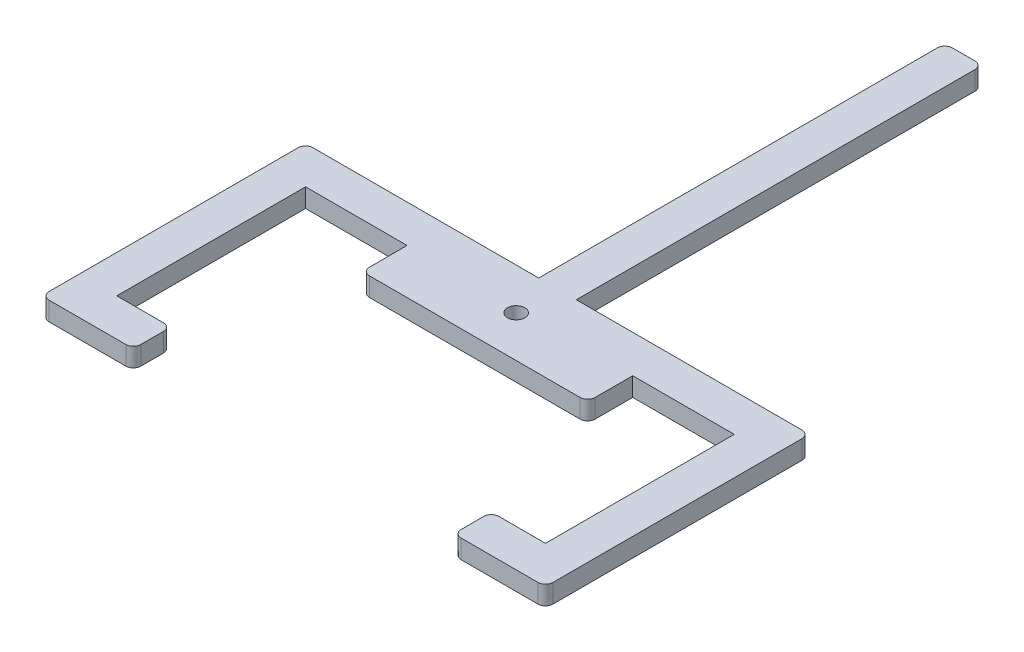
SolidWorks part; units mm, degrees
ref_plane "Front Plane" through (0, 0, 0) normal (0, 0, 1) x (1, 0, 0)
ref_plane "Top Plane" through (0, 0, 0) normal (0, 1, 0) x (1, 0, 0)
ref_plane "Right Plane" through (0, 0, 0) normal (1, 0, 0) x (0, 0, -1)
sketch "Sketch1" plane through (0, 0, 0) normal (0, 1, 0) x (1, 0, 0)
  line L0 (0, 0) -> (0, -68.58)
  line L1 (0, -79.375) -> (-15.875, -79.375)
  line L2 (-39.37, -68.58) -> (-39.37, -109.982)
  line L3 (-39.37, -109.982) -> (-33.02, -109.982)
  line L4 (0, -74.93) -> (0, -79.375)
  line L5 (-15.875, -82.55) -> (22.225, -82.55)
  line L6 (39.37, -74.93) -> (39.37, -109.982)
  line L7 (39.37, -109.982) -> (45.72, -109.982)
  line L8 (45.72, -68.58) -> (45.72, -109.982)
  line L9 (22.225, -79.375) -> (6.35, -79.375)
  line L10 (0, -68.58) -> (6.35, -68.58) construction
  line L11 (6.35, 0) -> (0, 0)
  line L12 (0, -74.93) -> (-33.02, -74.93)
  line L13 (-33.02, -74.93) -> (-33.02, -109.982)
  line L14 (0, -68.58) -> (-39.37, -68.58)
  line L15 (6.35, -77.1525) -> (0, -77.1525) construction
  line L16 (-15.875, -79.375) -> (-15.875, -82.55)
  line L18 (22.225, -79.375) -> (22.225, -82.55)
  line L19 (6.35, -68.58) -> (45.72, -68.58)
  line L20 (6.35, -74.93) -> (6.35, -79.375)
  line L21 (3.175, -77.1525) -> (3.175, -82.55) construction
  line L22 (39.37, -74.93) -> (6.35, -74.93)
  line L23 (6.35, -68.58) -> (6.35, 0)
  point P1 (3.175, -68.58)
  dimension "D2" = 6.35
  dimension "D3" = 6.35
  dimension "D4" = 3.175
  dimension "D5" = 72.39
  dimension "D6" = 41.402
  dimension "D7" = 6.35
  dimension "D8" = 6.35
  dimension "D9" = 38.1
  dimension "D10" = 41.402
  dimension "D11" = 68.58
  dimension "D12" = 6.35
  dimension "D13" = 4.445
extrude "Boss-Extrude1" add sketch "Sketch1" along normal blind 3.175
sketch "Sketch2" plane through (0, 0, 0) normal (0, 1, 0) x (1, 0, 0)
  line L0 (-39.37, -68.58) -> (-39.37, -109.982) construction
  line L1 (-39.37, -106.807) -> (-23.876, -106.807)
  line L2 (-39.37, -106.807) -> (-39.37, -113.157)
  line L3 (-39.37, -113.157) -> (-23.876, -113.157)
  line L4 (-23.876, -106.807) -> (-23.876, -113.157)
  line L5 (-39.37, -109.982) -> (-33.02, -109.982) construction
  line L6 (3.175, 0) -> (3.175, -111.8396) construction
  line L7 (6.35, 0) -> (0, 0) construction
  line L8 (30.226, -106.807) -> (30.226, -113.157)
  line L9 (45.72, -113.157) -> (30.226, -113.157)
  line L10 (45.72, -106.807) -> (45.72, -113.157)
  line L11 (45.72, -106.807) -> (30.226, -106.807)
  point P6 (-39.37, -109.982)
  dimension "D1" = 6.35
  dimension "D2" = 15.494
extrude "Boss-Extrude2" add sketch "Sketch2" along normal blind 3.175
hole_wizard "#4 Clearance Hole1" positions "Sketch4" profile "Sketch3" hole size "#4" standard "ANSI Inch"
sketch "Sketch4" plane through (0, 3.175, 0) normal (0, 1, 0) x (1, 0, 0)
  line L1 (-15.875, -82.55) -> (22.225, -82.55) construction
  line L2 (7.7117, -68.58) -> (7.7117, -82.55) construction
  line L3 (45.72, -68.58) -> (6.35, -68.58) construction
  point P0 (3.175, -75.565)
  point P7 (3.175, -82.55)
  point P16 (7.7117, -75.565)
sketch "Sketch3" plane through (3.175, 3.175, 75.565) normal (1, 0, 0) x (0, 0, 1)
  line L0 (0, 0) -> (0, 3.175)
  line L1 (0, 3.175) -> (1.4732, 3.175)
  line L2 (1.4732, 3.175) -> (1.4732, 0)
  line L5 (1.4732, 0) -> (0, 0)
  line L11 (0, -6.35) -> (0, 107.95) construction
  dimension "Thru Hole Dia." = 2.9464
  dimension "Thru Hole Depth" = 3.175
sketch "Sketch5" plane through (0, 0, 0) normal (0, 1, 0) x (1, 0, 0)
  line L1 (0, -74.93) -> (-15.875, -74.93)
  line L2 (0, -74.93) -> (0, -79.375)
  line L3 (0, -79.375) -> (-15.875, -79.375)
  line L4 (-15.875, -74.93) -> (-15.875, -79.375)
  line L5 (6.35, -74.93) -> (22.225, -74.93)
  line L6 (6.35, -74.93) -> (6.35, -79.375)
  line L7 (6.35, -79.375) -> (22.225, -79.375)
  line L8 (22.225, -74.93) -> (22.225, -79.375)
extrude "Boss-Extrude3" add sketch "Sketch5" along normal blind 3.175
fillet "Fillet1" radius 1.27 12 edges at (-23.876, 1.5875, 106.807) (45.72, 1.5875, 113.157) (30.226, 1.5875, 106.807) (30.226, 1.5875, 113.157) (22.225, 1.5875, 82.55) (-23.876, 1.5875, 113.157) (-39.37, 1.5875, 113.157) (-15.875, 1.5875, 82.55) (45.72, 1.5875, 68.58) (-39.37, 1.5875, 68.58) (6.35, 1.5875, 0) (0, 1.5875, 0)
